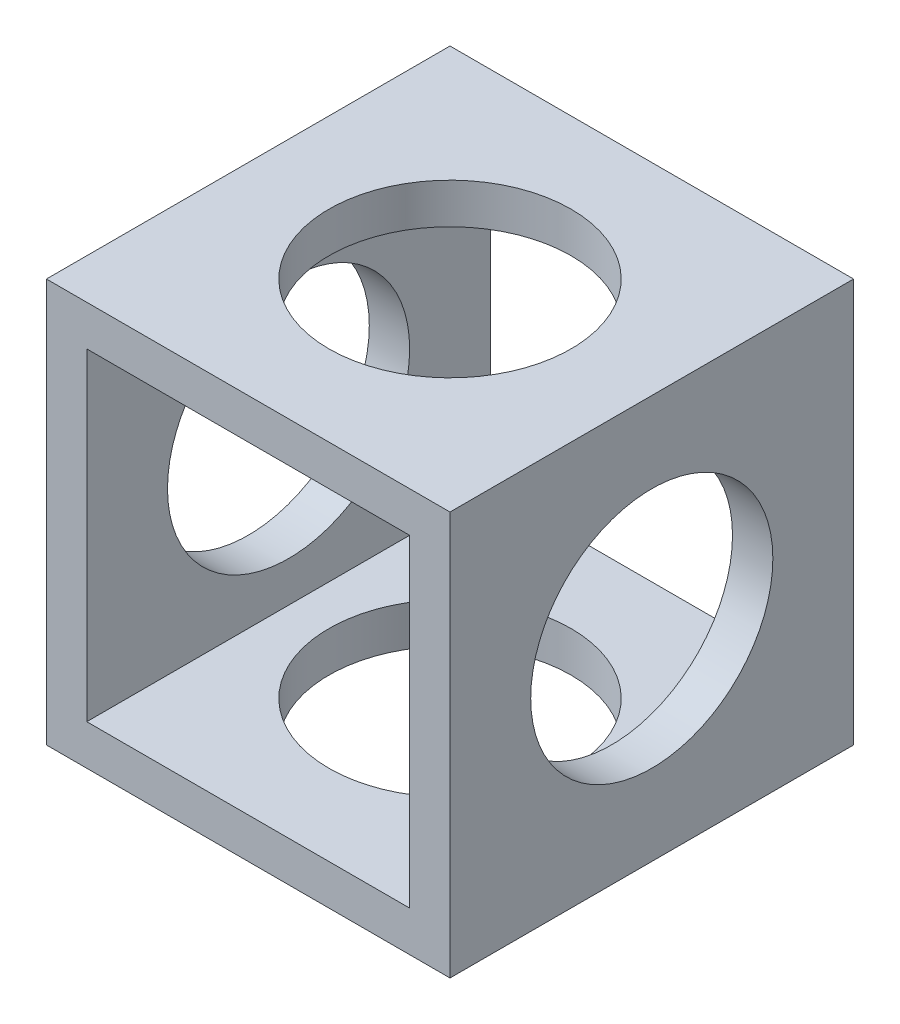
SolidWorks part; units mm, degrees
ref_plane "Front Plane" through (0, 0, 0) normal (0, 0, 1) x (1, 0, 0)
ref_plane "Top Plane" through (0, 0, 0) normal (0, 1, 0) x (1, 0, 0)
ref_plane "Right Plane" through (0, 0, 0) normal (1, 0, 0) x (0, 0, -1)
sketch "Sketch1" plane through (0, 0, 0) normal (0, 0, 1) x (1, 0, 0)
  line L0 (5, 5) -> (45, 5)
  line L1 (0, 0) -> (50, 0)
  line L2 (0, 0) -> (0, 50)
  line L3 (0, 50) -> (50, 50)
  line L4 (50, 0) -> (50, 50)
  line L5 (45, 5) -> (45, 45)
  line L6 (5, 45) -> (45, 45)
  line L7 (5, 5) -> (5, 45)
  dimension "D1" = 50
  dimension "D2" = 50
  dimension "D3" = 5
extrude "Extrude1" add sketch "Sketch1" against normal blind 50
sketch "Sketch2" plane through (50, 0, 0) normal (1, 0, 0) x (0, 0, -1)
  line L3 (50, 50) -> (0, 0) construction
  line L4 (0, 50) -> (50, 0) construction
  circle A0 centre (25, 25) radius 15
  dimension "D1" = 30
extrude "Cut-Extrude1" cut sketch "Sketch2" against normal through all
sketch "Sketch3" plane through (0, 50, 0) normal (0, 1, 0) x (1, 0, 0)
  line L0 (50, 50) -> (0, 0) construction
  line L1 (0, 50) -> (50, 0) construction
  circle A0 centre (25, 25) radius 15
  dimension "D1" = 30
extrude "Cut-Extrude2" cut sketch "Sketch3" against normal through all
